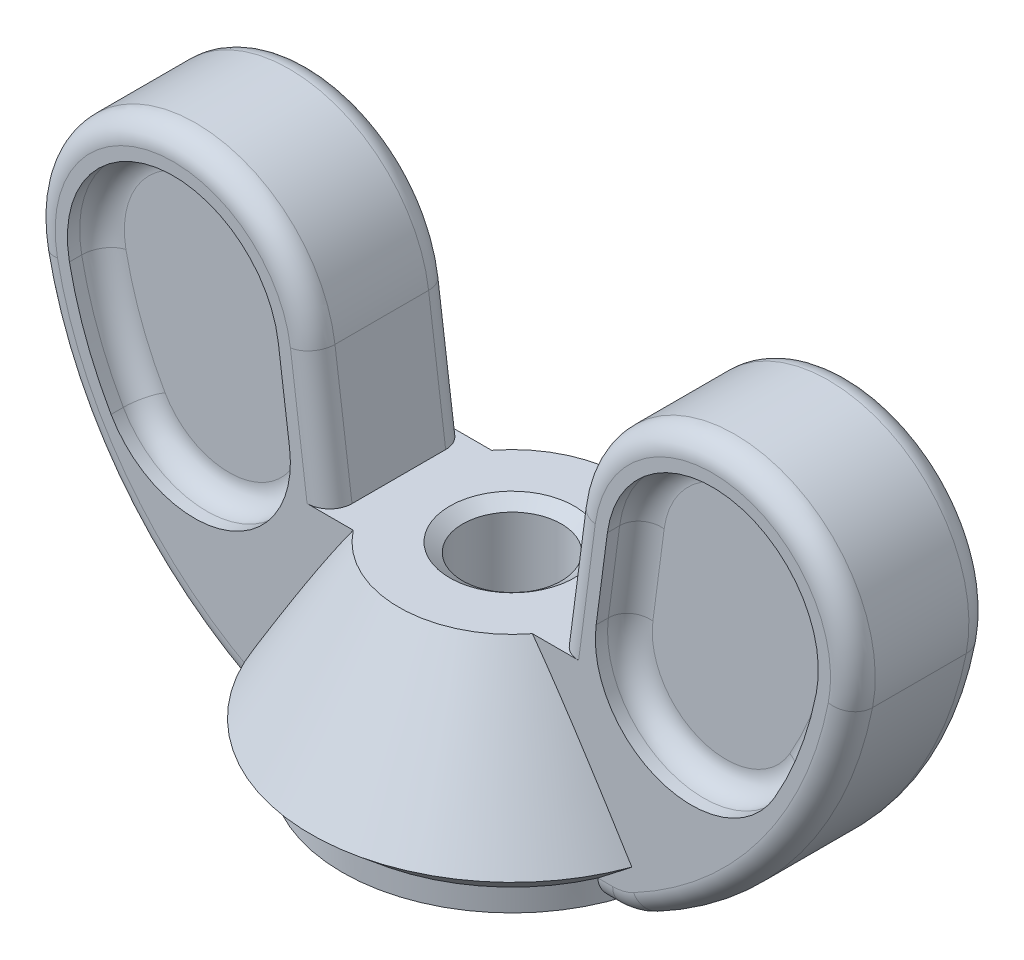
SolidWorks part; units mm, degrees
ref_plane "Front Plane" through (0, 0, 0) normal (0, 0, 1) x (1, 0, 0)
ref_plane "Top Plane" through (0, 0, 0) normal (0, 1, 0) x (1, 0, 0)
ref_plane "Right Plane" through (0, 0, 0) normal (1, 0, 0) x (0, 0, -1)
sketch "WingSke" plane through (0, 0, 0) normal (0, 0, 1) x (1, 0, 0)
  line L0 (-98.8178, 0) -> (98.8178, 0) construction
  line L1 (4.4704, 0) -> (-4.4704, 0) construction
  line L2 (0, 62.7504) -> (0, -62.7504) construction
  line L3 (-2.286, 4.064) -> (2.286, 4.064)
  line L4 (2.286, 4.064) -> (2.63, 6.677)
  line L7 (3.429, 0) -> (-3.429, 0)
  line L10 (-2.63, 6.677) -> (-2.286, 4.064)
  arc A0 (2.63, 6.677) -> (8.2261, 5.7536) centre (5.4431, 6.3066) cw
  arc A1 (8.2261, 5.7536) -> (4.064, 0.158) centre (0.254, 7.3378) cw
  arc A2 (4.064, 0.158) -> (3.429, 0) centre (3.429, 1.3547) cw
  arc A3 (-3.429, 0) -> (-4.064, 0.158) centre (-3.429, 1.3547) cw
  arc A4 (-4.064, 0.158) -> (-8.2261, 5.7536) centre (-0.254, 7.3378) cw
  arc A5 (-8.2261, 5.7536) -> (-2.63, 6.677) centre (-5.4431, 6.3066) cw
  circle A6 centre (0, 0) radius 4.064 construction
  circle A7 centre (0, 0) radius 3.429 construction
  point P29 (0, 0)
extrude "Wing" add sketch "WingSke" along normal mid plane 2.794
sketch "BossSke" plane through (0, 0, 0) normal (0, 0, 1) x (1, 0, 0)
  line L0 (-2.286, 4.064) -> (-4.064, 0.9844)
  line L1 (2.286, 4.064) -> (-2.286, 4.064) construction
  line L3 (-3.429, 0) -> (0, 0)
  line L4 (0, 0) -> (0, 4.064)
  line L5 (0, 4.064) -> (-2.286, 4.064)
  line L7 (-3.429, 0) -> (-3.429, 0.4516)
  line L8 (-3.429, 0.4516) -> (-4.064, 0.9844)
  line L9 (3.429, 0) -> (-3.429, 0) construction
  line L10 (-4.064, 0.9844) -> (-4.064, 0) construction
  line L11 (-98.8178, 0) -> (98.8178, 0) construction
  circle A1 centre (0, 0) radius 4.064 construction
revolve "Boss" add sketch "BossSke" angle 360 about L4
sketch "BossHoleSke" plane through (0, 0, 0) normal (0, 0, 1) x (1, 0, 0)
  line L0 (0, 4.064) -> (0, 0)
  line L1 (1.8095, 4.064) -> (-1.8095, 4.064) construction
  line L2 (0, 0) -> (0.9969, 0)
  line L3 (4.4704, 0) -> (-4.4704, 0) construction
  line L5 (0.9969, 0) -> (0.9969, 4.064)
  line L7 (0.9969, 4.064) -> (0, 4.064)
  line L8 (0, 4.064) -> (0, 8.128) construction
revolve "BossHole" cut sketch "BossHoleSke" angle 360 about L8
sketch "Sketch7" plane through (0, 0, 0) normal (0, 0, 1) x (1, 0, 0)
  line L0 (0.997, 3.8817) -> (1.2573, 4.064)
  line L1 (0.9969, 0) -> (0.9969, 4.064) construction
  line L2 (1.8095, 4.064) -> (-1.8095, 4.064) construction
  line L5 (0.9969, 4.064) -> (0.997, 3.8817)
  line L6 (0.997, 0.1823) -> (0.997, 0)
  line L7 (0.997, 0) -> (1.2573, 0)
  line L8 (-4.4167, 0) -> (4.4167, 0) construction
  line L9 (1.2573, 0) -> (0.997, 0.1823)
  line L10 (0.9969, 4.064) -> (1.2573, 4.064)
revolve "Cut-Revolve2" cut sketch "Sketch7" angle 360 about L2
sketch "Sketch10" plane through (0, 0, 0) normal (0, 0, 1) x (1, 0, 0)
  line L0 (-3.3225, 6.5858) -> (-3.0954, 4.8604)
  line L1 (-3.3225, 6.5858) -> (-2.63, 6.677) construction
  line L2 (-2.63, 6.677) -> (-2.286, 4.064) construction
  line L3 (-4.6689, 1.3336) -> (-2.8909, 4.4132) construction
  line L4 (-2.286, 4.064) -> (-4.064, 0.9844) construction
  line L5 (-2.286, 4.064) -> (-2.8909, 4.4132) construction
  line L6 (3.3225, 6.5858) -> (3.0954, 4.8604)
  line L7 (2.286, 4.064) -> (2.63, 6.677) construction
  arc A0 (-7.541, 5.8897) -> (-3.3225, 6.5858) centre (-5.4431, 6.3066) cw
  arc A1 (-3.0954, 4.8604) -> (-6.6997, 3.6432) centre (-5.0176, 4.6073) cw
  arc A2 (-6.6997, 3.6432) -> (-7.541, 5.8897) centre (-0.254, 7.3378) cw
  arc A3 (-8.2261, 5.7536) -> (-4.064, 0.158) centre (-0.254, 7.3378) ccw construction
  arc A4 (3.3225, 6.5858) -> (7.541, 5.8897) centre (5.4431, 6.3066) cw
  arc A5 (7.541, 5.8897) -> (6.6997, 3.6432) centre (0.254, 7.3378) cw
  arc A6 (6.6997, 3.6432) -> (3.0954, 4.8604) centre (5.0176, 4.6073) cw
  arc A7 (4.064, 0.158) -> (8.2261, 5.7536) centre (0.254, 7.3378) ccw construction
extrude "WingIndent1" cut sketch "Sketch10" along normal through all from offset 0.6985
mirror "Mirror1" about plane through (0, 0, 0) normal (0, 0, 1) of "WingIndent1"
fillet "WingFillet" radius 0.4516 36 edges at (3.2803, 0, -1.397) (3.7562, 0.0401, -1.397) (6.7757, 2.4867, -1.397) (5.9051, 9.1061, -1.397) (-3.2803, 0, -1.397) (-3.7562, 0.0401, -1.397) (-6.7757, 2.4867, -1.397) (-5.9051, 9.1061, -1.397) (3.2803, 0, 1.397) (3.7562, 0.0401, 1.397) (6.7757, 2.4867, 1.397) (5.9051, 9.1061, 1.397) (-3.2803, 0, 1.397) (-3.7562, 0.0401, 1.397) (-6.7757, 2.4867, 1.397) (-5.9051, 9.1061, 1.397) (2.458, 5.3705, -1.397) (-2.458, 5.3705, -1.397) (2.458, 5.3705, 1.397) (-2.458, 5.3705, 1.397) (3.209, 5.7231, -0.6985) (5.7914, 8.417, -0.6985) (7.2117, 4.7323, -0.6985) (-5.7914, 8.417, -0.6985) (-3.209, 5.7231, -0.6985) (-4.3973, 2.7704, -0.6985) (-5.7914, 8.417, 0.6985) (-3.209, 5.7231, 0.6985) (-4.3973, 2.7704, 0.6985) (3.209, 5.7231, 0.6985) (5.7914, 8.417, 0.6985) (7.2117, 4.7323, 0.6985) (4.3973, 2.7704, -0.6985) (-7.2117, 4.7323, -0.6985) (-7.2117, 4.7323, 0.6985) (4.3973, 2.7704, 0.6985)
sketch "ThdSchSke" plane through (0, 0, 0) normal (0, 0, 1) x (1, 0, 0)
  line L0 (0, 0) -> (0, 4.064) construction
  line L1 (1.8095, 4.064) -> (-1.8095, 4.064) construction
  line L2 (-0.4985, 4.2209) -> (-0.4985, 3.8563)
  line L3 (-0.4985, 3.8563) -> (-0.9969, 3.8563)
  line L4 (-0.9969, 3.8563) -> (-1.2573, 4.0386)
  line L5 (-1.2573, 4.0386) -> (-0.9969, 4.2209)
  line L6 (-0.9969, 4.2209) -> (-0.4985, 4.2209)
  line L7 (0, 3.5103) -> (2.1821, 3.5103) construction
revolve "ThreadSchematic" [suppressed] cut sketch "ThdSchSke" angle 360 about L0
pattern_linear "ThdSchPat" [suppressed]
equation "\"R@WingSke\" = \"BossHeightG@WingSke\" / 3"
equation "\"D2@WingSke\"=\"BossHeightG@WingSke\"*2"
equation "\"D1@WingFillet\"=\"R@WingSke\"/3"
equation "\"Tap_drill@ThdSchSke\" = \"Thread_min@BossHoleSke\""
equation "\"Thread_major@ThdSchSke\" = \"Thread_Major@ThreadCosmetic\""
equation "\"D1@ThdSchSke\" = \"Tap_drill@ThdSchSke\" * 0.5"
equation "\"Advance@ThdSchPat\" =  ( \"BossHeightG@WingSke\" - 0.002 )  /  ( \"Num_Threads@ThdSchPat\" - 1 ) 'relax it"
equation "\"Num_Threads@ThdSchPat\"=int(  (\"BossHeightG@WingSke\" - 0.002 ) / \"Advance@ThdSchSke\" + 0.999 )  + 1"
equation "\"D3@Sketch7\" = \"Thread_Major@ThreadCosmetic\" * 0.5"
equation "\"D1@Sketch10\"=\"WingThicknessC@Wing\"/4"
equation "\"Offset@WingIndent1\"=\"WingThicknessC@Wing\"/4"
equation "\"D2@BossSke\"=\"R@WingSke\"/3"
